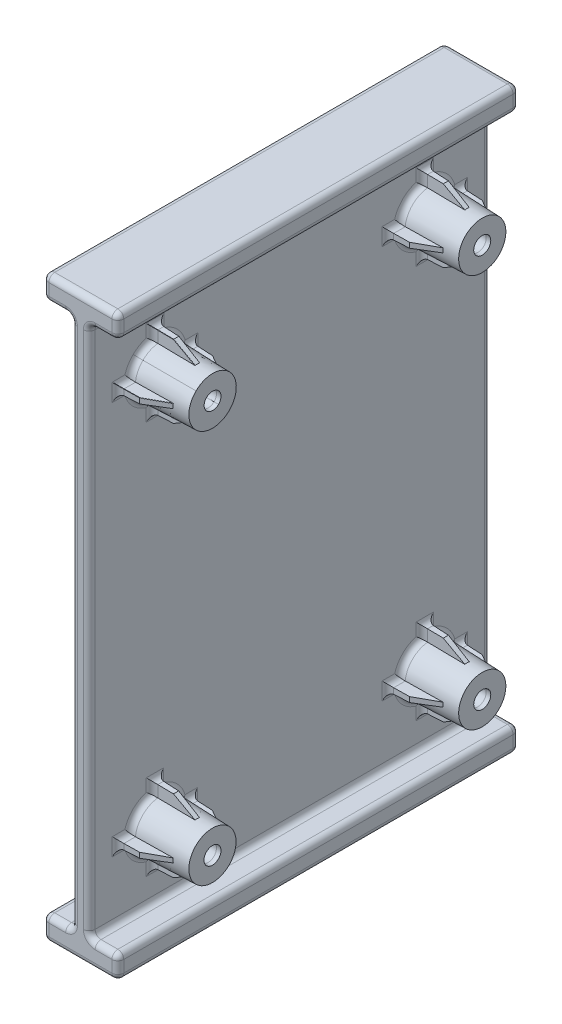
SolidWorks part; units mm, degrees
ref_plane "Front Plane" through (0, 0, 0) normal (0, 0, 1) x (1, 0, 0)
ref_plane "Top Plane" through (0, 0, 0) normal (0, 1, 0) x (1, 0, 0)
ref_plane "Right Plane" through (0, 0, 0) normal (1, 0, 0) x (0, 0, -1)
sketch "Sketch1" plane through (0, 0, 0) normal (0, 0, 1) x (1, 0, 0)
  line L0 (10.0952, 0) -> (-7.0952, 0)
  line L2 (-1.5, -45) -> (-1.5, 45)
  line L4 (1.5, -45) -> (1.5, 45)
  line L5 (-1.5, -45) -> (1.5, 45) construction
  line L6 (-1.5, 45) -> (1.5, -45) construction
  line L7 (-6.35, -49) -> (6.35, -49)
  line L8 (-6.35, -49) -> (-6.35, -45)
  line L10 (6.35, -49) -> (6.35, -45)
  line L11 (-6.35, -49) -> (6.35, -45) construction
  line L12 (-6.35, -45) -> (6.35, -49) construction
  line L14 (6.35, 49) -> (6.35, 45)
  line L15 (-6.35, 49) -> (6.35, 49)
  line L16 (-6.35, 49) -> (-6.35, 45)
  line L17 (-6.35, -45) -> (-1.5, -45)
  line L18 (1.5, -45) -> (6.35, -45)
  line L19 (-6.35, 45) -> (-1.5, 45)
  line L20 (1.5, 45) -> (6.35, 45)
  point P0 (0, 0)
  point P6 (0, -47)
  point P15 (1.5, 0)
  dimension "D1" = 3
  dimension "D2" = 90
  dimension "D3" = 4
  dimension "D4" = 12.7
extrude "Boss-Extrude1" add sketch "Sketch1" along normal mid plane 68 contours L18 L4 L0 L2 L17 L8 L7 L10 | L4 L20 L14 L15 L16 L19 L2 L0
sketch "Sketch3" plane through (1.5, 0, 0) normal (1, 0, 0) x (0, 0, -1)
  line L0 (0, 6.985) -> (0, -6.985) construction
  line L1 (6.985, 0) -> (-6.985, 0) construction
  point P0 (-22.86, 33.34)
  point P3 (22.86, 33.34)
  point P7 (22.86, -33.34)
  point P8 (-22.86, -33.34)
  dimension "MountLength" = 45.72
  dimension "MountWidth" = 66.68
sketch3d "3DSketch1"
  point P0 (1.5, 33.3744, 22.8249)
other "Mounting Boss1" parameters "BossHeight"=10, "BossDiam"=8, "StepHeight"=1, "StepDia"=2.9, "HoleDiam"=2.9, "CBoreDiam"=0, "CBoreDepth"=0, "HoleDepth"=7, "D9"=0, "D10"=0, "Clearance"=0.254, "FinLength"=6, "FinWidth"=1, "FinHeight"=8, "ChamferDist"=2.4, "BossDraft"=2, "HoleDraft"=1, "StepDraft"=1.5, "D19"=0, "FinDraft"=1, "ChamferAngle"=60
pattern_sketch "Sketch-Pattern3" of "Mounting Boss1"
fillet "Fillet1" radius 1 127 edges at (1.5, 0, 34) (1.5, 37.2784, 24.7218) (1.5, 38.6505, 23.36) (1.5, 39.6194, 23.3425) (1.5, 32.84, 17.5491) (1.5, 32.8572, 16.5806) (1.5, 28.0446, 23.36) (1.5, 27.0778, 22.36) (1.5, 27.0606, 22.86) (1.5, 33.84, 29.1218) (1.5, 32.84, 28.1554) (1.5, 33.34, 29.1394) (1.5, 35.2758, 26.7449) (1.5, 30.2709, 25.9291) (1.5, 29.436, 20.9631) (8.9739, 30.4438, 19.9872) (6.35, -47, -34) (0, -49, -34) (-6.35, -47, -34) (-3.925, -45, -34) (-1.5, 0, -34) (3.925, 45, 34) (-3.925, 45, -34) (-6.35, 47, -34) (1.5, 38.6354, -23.36) (1.5, 38.6354, -22.36) (1.5, 39.6194, -22.86) (0, 49, -34) (1.5, 32.84, -28.1554) (1.5, 33.84, -28.1554) (1.5, 33.34, -29.1394) (1.5, 28.0446, -22.36) (1.5, 28.0446, -23.36) (1.5, 27.0606, -22.86) (1.5, 33.84, -17.5646) (1.5, 32.84, -17.5646) (1.5, 33.34, -16.5806) (1.5, 30.2709, -25.9291) (1.5, 36.4091, -25.9291) (1.5, 36.4091, -19.7909) (6.35, 47, -34) (1.5, 30.2709, -19.7909) (3.925, 45, -34) (1.5, 0, -34) (3.925, -45, -34) (1.5, -28.0446, -23.36) (1.5, -28.0446, -22.36) (1.5, -27.0606, -22.86) (1.5, -33.84, -28.1554) (1.5, -32.84, -28.1554) (6.35, 47, 34) (1.5, -33.34, -29.1394) (1.5, -38.6354, -22.36) (1.5, -38.6354, -23.36) (1.5, -39.6194, -22.86) (1.5, -32.84, -17.5646) (1.5, -33.84, -17.5646) (1.5, -33.34, -16.5806) (1.5, -36.4091, -25.9291) (1.5, -30.2709, -25.9291) (1.5, -30.2709, -19.7909) (1.5, -36.4091, -19.7909) (6.35, -45, 0) (6.35, -49, 0) (-6.35, -49, 0) (-6.35, -45, 0) (-1.5, -45, 0) (-1.5, 45, 0) (-6.35, 45, 0) (1.5, -28.0446, 22.36) (1.5, -28.0446, 23.36) (-6.35, 49, 0) (1.5, -27.0606, 22.86) (1.5, -33.84, 17.5646) (6.35, 49, 0) (1.5, -32.84, 17.5646) (1.5, -33.34, 16.5806) (6.35, 45, 0) (1.5, -38.6354, 23.36) (1.5, -38.6354, 22.36) (1.5, 45, 0) (1.5, -39.6194, 22.86) (1.5, -32.84, 28.1554) (1.5, -33.84, 28.1554) (1.5, -45, 0) (1.5, -33.34, 29.1394) (1.5, -36.4091, 19.7909) (1.5, -30.2709, 19.7909) (1.5, -30.2709, 25.9291) (1.5, -36.4091, 25.9291) (0, 49, 34) (-6.35, 47, 34) (-3.925, 45, 34) (-1.5, 0, 34) (-3.925, -45, 34) (1.5, 36.4435, 19.7558) (1.5, 38.6698, 22.3249) (1.5, 39.6365, 23.3249) (1.5, 39.6537, 22.8249) (1.5, 33.8744, 17.5295) (1.5, 33.3744, 16.5456) (3.925, -45, 34) (1.5, 28.0638, 22.3249) (1.5, 33.8572, 29.1043) (-6.35, -47, 34) (0, -49, 34) (6.35, -47, 34) (1.5, 33.8744, 28.1359) (1.5, 27.095, 22.3425) (1.5, 32.8744, 16.5631) (1.5, 31.4386, 18.9401)
